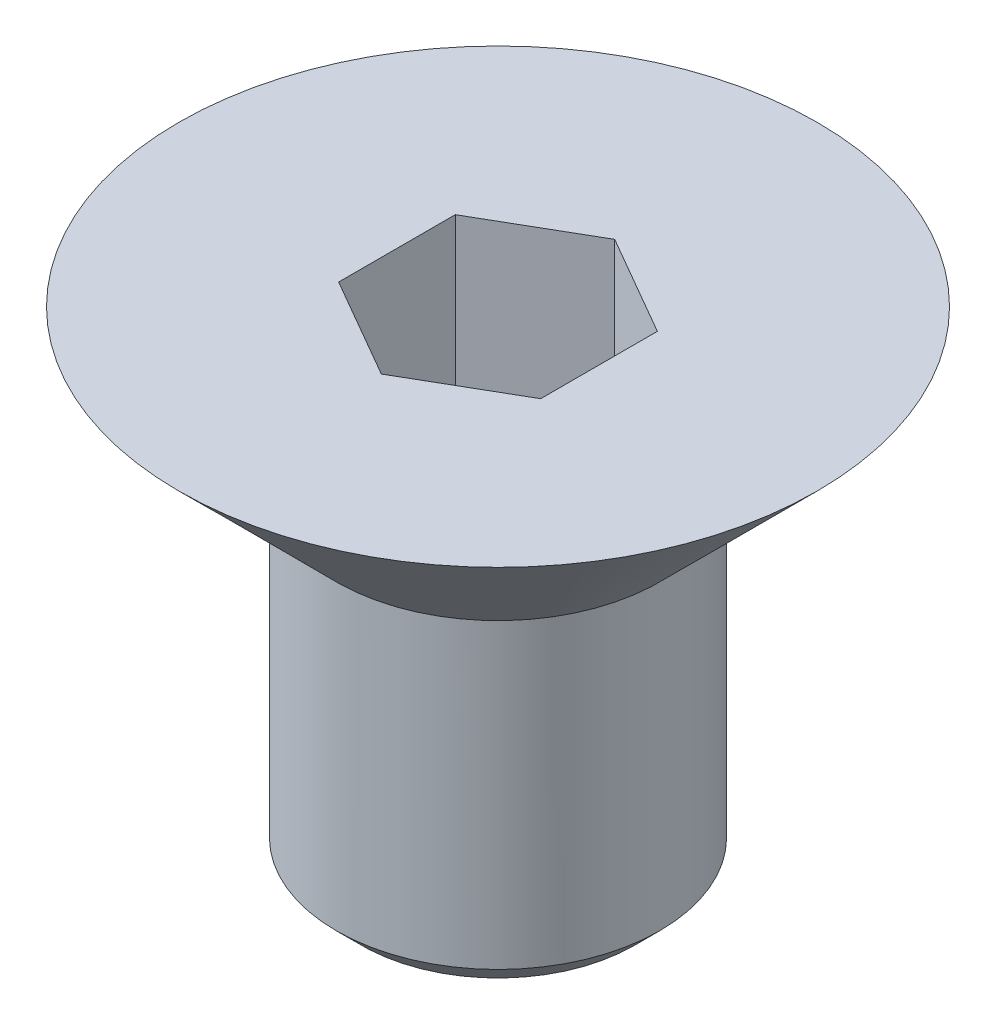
SolidWorks part; units mm, degrees
ref_plane "Face" through (0, 0, 0) normal (0, 0, 1) x (1, 0, 0)
ref_plane "Dessus" through (0, 0, 0) normal (0, 1, 0) x (1, 0, 0)
ref_plane "Droite" through (0, 0, 0) normal (1, 0, 0) x (0, 0, -1)
revolve "corps" add sketch "E_corps"
sketch "E_corps" plane through (0, 0, 0) normal (0, 0, 1) x (1, 0, 0)
  line L0 (0, 65.1173) -> (0, -12) construction
  line L1 (0, 0) -> (7.9, 0)
  line L2 (7.9, 0) -> (4, -3.9)
  line L3 (4, -3.9) -> (4, -12)
  line L4 (4, -12) -> (0, -12)
  line L5 (0, -12) -> (0, 0)
  line L7 (50, 0) -> (-50, 0) construction
  dimension "Diamètre_nominal" = 8
  dimension "Diamètre_de_tête" = 15.8
  dimension "D1" = 45
  dimension "D2" = 3.9
  dimension "Longueur_sous_tête" = 12
chamfer "Chanfrein1" distance 0.625 angle 45 1 edges at (-4, -12, 0)
sketch "E_6_pans_creux" plane through (0, 0, 0) normal (0, 1, 0) x (-1, 0, 0)
  line L0 (0, 6.3383) -> (0, -7.3536) construction
  line L1 (0, 2.8868) -> (2.5, 1.4434)
  line L2 (0, 2.8868) -> (-2.5, 1.4434)
  line L3 (2.5, 1.4434) -> (2.5, -1.4434)
  line L4 (-2.5, 1.4434) -> (-2.5, -1.4434)
  line L5 (2.5, -1.4434) -> (0, -2.8868)
  line L6 (-2.5, -1.4434) -> (0, -2.8868)
  circle A0 centre (0, 0) radius 2.8868 construction
  dimension "a" = 5
extrude "Empreinte_6_pans_creux" cut sketch "E_6_pans_creux" against normal blind 7.2
equation "\"profondeur@Empreinte_6_pans_creux\" = 0.9*\"Diamètre_nominal@E_corps\""
equation "\"D1@Représentation de filetage1\" = \"Longueur_sous_tête@E_corps\" - \"D2@E_corps\""
